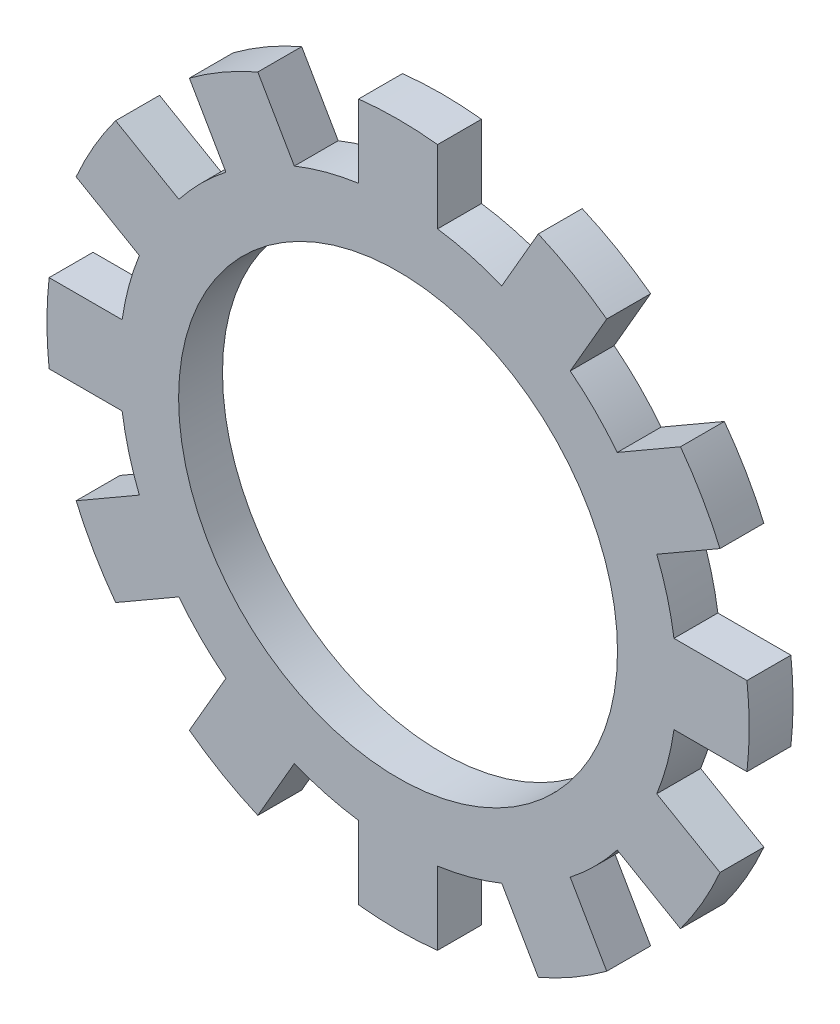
SolidWorks part; units mm, degrees
ref_plane "Front Plane" through (0, 0, 0) normal (0, 0, 1) x (1, 0, 0)
ref_plane "Top Plane" through (0, 0, 0) normal (0, 1, 0) x (1, 0, 0)
ref_plane "Right Plane" through (0, 0, 0) normal (1, 0, 0) x (0, 0, -1)
sketch "Sketch1" plane through (0, 0, 0) normal (0, 0, 1) x (1, 0, 0)
  circle A0 centre (0, 0) radius 2.5
  circle A1 centre (0, 0) radius 3.175
  dimension "D1" = 5
  dimension "D2" = 6.35
extrude "Boss-Extrude1" add sketch "Sketch1" along normal mid plane 0.5
sketch "Sketch2" plane through (0, 0, 0) normal (0, 0, 1) x (1, 0, 0)
  line L0 (0, 2.6811) -> (0, -2.8425) construction
sketch "Sketch3" plane through (0, 0, 0) normal (0, 0, 1) x (1, 0, 0)
  line L0 (-0.45, 3.9746) -> (-0.45, 3.1429)
  line L2 (0, 2.6811) -> (0, -2.8425) construction
  line L3 (0, 3.175) -> (0, 4)
  arc A0 (0, 4) -> (-0.45, 3.9746) centre (0, 0) ccw
  arc A1 (0, 3.175) -> (-0.45, 3.1429) centre (0, 0) ccw
  circle A2 centre (0, 0) radius 3.175 construction
  dimension "D2" = 4
  dimension "D1" = 0.45
extrude "Boss-Extrude2" add sketch "Sketch3" along normal mid plane 0.5
mirror "Mirror1" about plane through (0, 0, 0) normal (1, 0, 0) of "Boss-Extrude2"
pattern_circular "CirPattern2" count 12 over 360 about axis through (0, 0, 0) along (0, 0, 1) of "Boss-Extrude2", "Mirror1"
